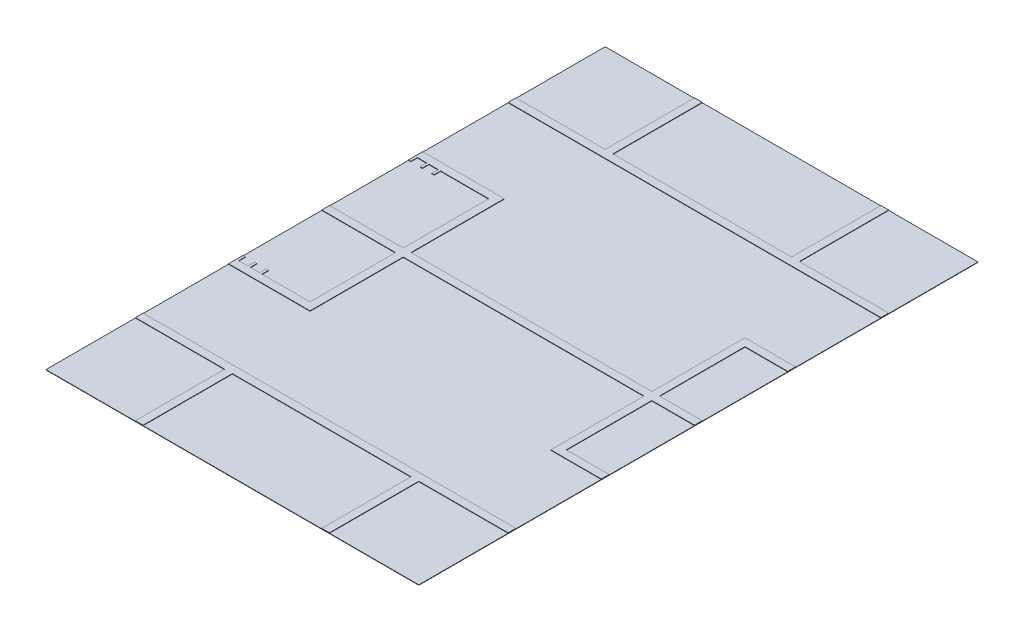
SolidWorks part; units mm, degrees
ref_plane "Front Plane" through (0, 0, 0) normal (0, 0, 1) x (1, 0, 0)
ref_plane "Top Plane" through (0, 0, 0) normal (0, 1, 0) x (1, 0, 0)
ref_plane "Right Plane" through (0, 0, 0) normal (1, 0, 0) x (0, 0, -1)
sketch "Sketch1" plane through (0, 0, 0) normal (0, 1, 0) x (1, 0, 0)
  line L1 (0, 0) -> (2438.4, 0)
  line L2 (0, 0) -> (0, 3657.6)
  line L3 (0, 3657.6) -> (2438.4, 3657.6)
  line L4 (2438.4, 0) -> (2438.4, 3657.6)
  dimension "D1" = 2438.4
  dimension "D2" = 3657.6
extrude "Boss-Extrude1" add sketch "Sketch1" along normal blind 2.54
sketch "Sketch2" plane through (0, 2.54, 0) normal (0, 1, 0) x (1, 0, 0)
  line L0 (0, 1828.8) -> (2438.4, 1828.8) construction
  line L1 (0, 3657.6) -> (0, 0) construction
  line L2 (2438.4, 0) -> (2438.4, 3657.6) construction
  line L3 (0, 0) -> (2438.4, 0) construction
  line L4 (0, 1803.4) -> (2108.2, 1803.4)
  line L5 (0, 1803.4) -> (0, 1854.2)
  line L6 (0, 1854.2) -> (2108.2, 1854.2)
  line L7 (2438.4, 1803.4) -> (2438.4, 1854.2)
  line L8 (0, 635) -> (2438.4, 635)
  line L9 (0, 635) -> (0, 609.6)
  line L10 (0, 609.6) -> (2438.4, 609.6) construction
  line L11 (2438.4, 635) -> (2438.4, 609.6)
  line L12 (0, 609.6) -> (0, 0)
  line L13 (0, 0) -> (609.6, 0)
  line L14 (609.6, 0) -> (609.6, 609.6) construction
  line L15 (1828.8, 609.6) -> (1828.8, 0) construction
  line L16 (1828.8, 0) -> (2438.4, 0)
  line L17 (2438.4, 0) -> (2438.4, 609.6)
  line L18 (0, 584.2) -> (584.2, 584.2)
  line L20 (0, 1803.4) -> (0, 1287.4625)
  line L21 (15.875, 1244.6) -> (76.2, 1244.6)
  line L22 (482.6, 1803.4) -> (482.6, 1244.6)
  line L23 (2438.4, 1219.2) -> (2133.6, 1219.2) construction
  line L26 (2133.6, 1219.2) -> (2133.6, 1828.8) construction
  line L27 (1803.4, 584.2) -> (1803.4, 0)
  line L28 (635, 0) -> (635, 584.2)
  line L29 (635, 584.2) -> (1803.4, 584.2)
  line L30 (1854.2, 584.2) -> (1854.2, 0)
  line L31 (584.2, 0) -> (584.2, 584.2)
  line L32 (584.2, 0) -> (584.2, 609.6) construction
  line L33 (635, 0) -> (635, 609.6) construction
  line L34 (1854.2, 584.2) -> (2438.4, 584.2)
  line L35 (0, 584.2) -> (2438.4, 584.2) construction
  line L36 (1803.4, 609.6) -> (1803.4, 0) construction
  line L37 (1854.2, 609.6) -> (1854.2, 0) construction
  line L38 (533.4, 1803.4) -> (533.4, 1193.8)
  line L39 (508, 1803.4) -> (508, 1219.2) construction
  line L40 (0, 1219.2) -> (508, 1219.2) construction
  line L41 (2159, 1803.4) -> (2438.4, 1803.4)
  line L42 (508, 1828.8) -> (508, 1219.2) construction
  line L43 (0, 1193.8) -> (533.4, 1193.8)
  line L44 (0, 1803.4) -> (482.6, 1803.4) construction
  line L45 (0, 1828.8) -> (508, 1828.8) construction
  line L46 (0, 1854.2) -> (533.4, 1854.2) construction
  line L47 (533.4, 1854.2) -> (533.4, 1193.8) construction
  line L48 (2108.2, 1193.8) -> (2108.2, 1803.4)
  line L49 (2438.4, 1193.8) -> (2108.2, 1193.8)
  line L50 (2108.2, 1193.8) -> (2108.2, 1854.2) construction
  line L51 (2159, 1244.6) -> (2159, 1803.4)
  line L52 (2438.4, 1244.6) -> (2159, 1244.6)
  line L53 (0, 2438.4) -> (508, 2438.4) construction
  line L54 (508, 1854.2) -> (508, 2438.4) construction
  line L55 (2133.6, 2438.4) -> (2133.6, 1828.8) construction
  line L56 (2133.6, 1219.2) -> (2133.6, 1828.8) construction
  line L57 (2438.4, 2438.4) -> (2133.6, 2438.4) construction
  line L58 (1828.8, 3048) -> (1828.8, 3657.6) construction
  line L59 (609.6, 3657.6) -> (609.6, 3048) construction
  line L60 (0, 3048) -> (2438.4, 3048) construction
  line L61 (2438.4, 2413) -> (2159, 2413)
  line L62 (2159, 2413) -> (2159, 1854.2)
  line L63 (2159, 1854.2) -> (2438.4, 1854.2)
  line L64 (2438.4, 2463.8) -> (2108.2, 2463.8)
  line L65 (2108.2, 2463.8) -> (2108.2, 1854.2)
  line L66 (0, 2463.8) -> (533.4, 2463.8)
  line L67 (2438.4, 1244.6) -> (2159, 1244.6) construction
  line L68 (533.4, 1854.2) -> (533.4, 2463.8)
  line L69 (1854.2, 3073.4) -> (2438.4, 3073.4)
  line L70 (584.2, 3657.6) -> (584.2, 3073.4)
  line L71 (1854.2, 3073.4) -> (1854.2, 3657.6)
  line L72 (635, 3073.4) -> (1803.4, 3073.4)
  line L73 (635, 3657.6) -> (635, 3073.4)
  line L74 (1803.4, 3073.4) -> (1803.4, 3657.6)
  line L75 (2438.4, 1219.2) -> (2133.6, 1219.2) construction
  line L76 (482.6, 1854.2) -> (482.6, 2413)
  line L77 (0, 2413) -> (482.6, 2413)
  line L78 (0, 1854.2) -> (0, 2413)
  line L79 (0, 3073.4) -> (584.2, 3073.4)
  line L80 (0, 3657.6) -> (609.6, 3657.6)
  line L81 (0, 3048) -> (0, 3657.6)
  line L82 (2438.4, 3022.6) -> (2438.4, 3048)
  line L83 (0, 3022.6) -> (0, 3048)
  line L84 (0, 3022.6) -> (2438.4, 3022.6)
  line L85 (2438.4, 1803.4) -> (2159, 1803.4) construction
  line L86 (2438.4, 1854.2) -> (2108.2, 1854.2) construction
  line L87 (2438.4, 1828.8) -> (2133.6, 1828.8) construction
  line L88 (2438.4, 1193.8) -> (2108.2, 1193.8) construction
  line L89 (2438.4, 1244.6) -> (2438.4, 1193.8)
  line L90 (2438.4, 2463.8) -> (2438.4, 2413)
  line L91 (15.875, 1266.0313) -> (76.2, 1266.0313) construction
  line L93 (152.4, 1244.6) -> (152.4, 1287.4625)
  line L94 (152.4, 1287.4625) -> (168.275, 1287.4625)
  line L95 (168.275, 1244.6) -> (168.275, 1287.4625)
  line L96 (76.2, 1244.6) -> (92.075, 1244.6)
  line L97 (76.2, 1244.6) -> (76.2, 1287.4625)
  line L98 (76.2, 1287.4625) -> (92.075, 1287.4625)
  line L99 (92.075, 1244.6) -> (92.075, 1287.4625)
  line L100 (0, 1244.6) -> (15.875, 1244.6)
  line L101 (0, 1244.6) -> (0, 1287.4625)
  line L102 (0, 1287.4625) -> (15.875, 1287.4625)
  line L103 (15.875, 1244.6) -> (15.875, 1287.4625)
  line L104 (92.075, 1244.6) -> (482.6, 1244.6)
  line L105 (92.075, 1266.0313) -> (152.4, 1266.0313) construction
  line L106 (0, 1244.6) -> (482.6, 1244.6) construction
  line L107 (15.875, 2391.5688) -> (76.2, 2391.5688) construction
  line L108 (92.075, 2391.5688) -> (152.4, 2391.5688) construction
  line L109 (168.275, 2413) -> (168.275, 2370.1375)
  line L110 (152.4, 2370.1375) -> (168.275, 2370.1375)
  line L111 (152.4, 2413) -> (152.4, 2370.1375)
  line L112 (92.075, 2413) -> (92.075, 2370.1375)
  line L113 (76.2, 2413) -> (76.2, 2370.1375)
  line L114 (76.2, 2370.1375) -> (92.075, 2370.1375)
  line L115 (15.875, 2413) -> (15.875, 2370.1375)
  line L116 (0, 2370.1375) -> (15.875, 2370.1375)
  line L117 (7.9375, 1287.4625) -> (7.9375, 1244.6) construction
  line L118 (84.1375, 1287.4625) -> (84.1375, 1244.6) construction
  line L119 (160.3375, 1287.4625) -> (160.3375, 1244.6) construction
  point P10 (0, 1828.8)
  point P141 (8.1362, 1244.6)
  point P142 (5.6985, 1287.4625)
  dimension "D2" = 25.4
  dimension "D3" = 609.6
  dimension "D1" = 50.8
  dimension "D4" = 609.6
  dimension "D5" = 609.6
  dimension "D10" = 609.6
  dimension "D11" = 508
  dimension "D12" = 304.8
  dimension "D13" = 609.6
  dimension "D14" = 76.2
  dimension "D17" = 42.8625
  dimension "D18" = 15.875
  dimension "D6" = 25.4
  dimension "D7" = 25.4
  dimension "D8" = 25.4
  dimension "D9" = 25.4
  dimension "D15" = 25.4
  dimension "D16" = 25.4
extrude "Boss-Extrude2" add sketch "Sketch2" along normal blind 2.54 contours L64 L65 L6 L4 L48 L49 L52 L51 L41 L63 L62 L61 M8 M10 | L77 L76 L6 L68 L66 M8 | L43 L38 L4 L22 L21 M8 | L84 L69 L71 L74 L72 L73 L70 L79 M8 M10 M11 | L30 L34 L17 L8 L18 L31 L13 L28 L29 L27 M10 M8 M9 | L100 L103 L102 M8 | L96 L99 L98 L97 | L93 L104 L95 L94 | L116 L115 L77 M8 | L113 L114 L112 L77 | L77 L111 L110 L109
